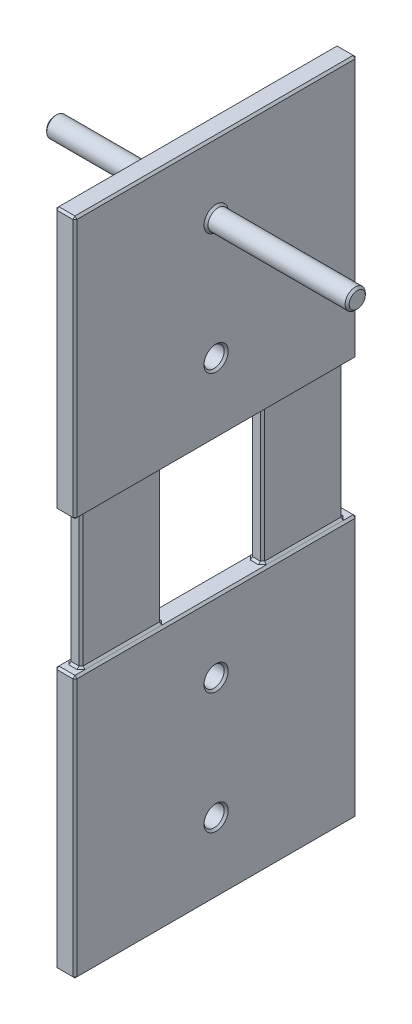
SolidWorks part; units mm, degrees
ref_plane "Спереди" through (0, 0, 0) normal (0, 0, 1) x (1, 0, 0)
ref_plane "Сверху" through (0, 0, 0) normal (0, 1, 0) x (1, 0, 0)
ref_plane "Справа" through (0, 0, 0) normal (1, 0, 0) x (0, 0, -1)
sketch "Эскиз1" plane through (0, 0, 0) normal (1, 0, 0) x (0, 0, -1)
  line L0 (0, 16.365) -> (0, -16.365) construction
  line L1 (-7, 0) -> (7, 0) construction
  line L2 (7, -3.365) -> (7, -16.365)
  line L3 (7, 3.365) -> (-7, 3.365)
  line L4 (7, 3.365) -> (7, 16.365)
  line L5 (7, 16.365) -> (-7, 16.365)
  line L6 (-7, 3.365) -> (-7, 16.365)
  line L7 (7, 3.365) -> (-7, 16.365) construction
  line L8 (7, 16.365) -> (-7, 3.365) construction
  line L9 (7, -3.365) -> (-7, -3.365)
  line L10 (-7, -3.365) -> (-7, -16.365)
  line L11 (7, -16.365) -> (-7, -16.365)
  circle A0 centre (0, 12.865) radius 0.5
  circle A1 centre (0, 6.865) radius 0.5
  circle A2 centre (0, -12.865) radius 0.5
  circle A3 centre (0, -6.865) radius 0.5
  point P5 (0, 9.865)
  dimension "D4" = 1
  dimension "D1" = 14
  dimension "D2" = 13
  dimension "D3" = 6.73
  dimension "D5" = 3.5
  dimension "D6" = 3.5
extrude "Бобышка-Вытянуть1" add sketch "Эскиз1" along normal mid plane 1
sketch "Эскиз3" plane through (0, 0, 0) normal (1, 0, 0) x (0, 0, -1)
  circle A0 centre (0, 12.865) radius 0.5 construction
  circle A1 centre (0, 12.865) radius 0.5
extrude "Бобышка-Вытянуть3" add sketch "Эскиз3" along normal mid plane 15
sketch "Эскиз2" plane through (0, 0, 0) normal (1, 0, 0) x (0, 0, -1)
  line L0 (0, 3.365) -> (0, -3.365) construction
  line L1 (-7, 3.365) -> (7, 3.365) construction
  line L2 (7, -3.365) -> (-7, -3.365) construction
  line L3 (-7, 16.365) -> (-7, 3.365) construction
  line L4 (-2.5, -3.365) -> (-6.5, -3.365)
  line L5 (-2.5, -3.365) -> (-2.5, 3.365)
  line L6 (-2.5, 3.365) -> (-6.5, 3.365)
  line L7 (-6.5, -3.365) -> (-6.5, 3.365)
  line L8 (-2.5, -3.365) -> (-6.5, 3.365) construction
  line L9 (-2.5, 3.365) -> (-6.5, -3.365) construction
  line L10 (2.5, -3.365) -> (2.5, 3.365)
  line L11 (2.5, -3.365) -> (6.5, -3.365)
  line L12 (6.5, -3.365) -> (6.5, 3.365)
  line L13 (2.5, 3.365) -> (6.5, 3.365)
  point P6 (-4.5, 0)
  dimension "D1" = 4
  dimension "D2" = 0.5
extrude "Бобышка-Вытянуть2" add sketch "Эскиз2" along normal mid plane 0.6
chamfer "Фаска1" distance 0.1 angle 45 34 edges at (-0.5, 6.865, -0.5) (-0.5, 12.865, -0.5) (-0.5, -6.865, 0.5) (-0.5, -12.865, 0.5) (0.5, -6.865, 0.5) (0, -16.365, -7) (0, -3.365, -7) (0, -3.365, 7) (-0.5, -9.865, 7) (-0.5, -3.365, 0) (-0.5, -9.865, -7) (-0.5, -16.365, 0) (0, -16.365, 7) (0.5, -9.865, -7) (0.5, -16.365, 0) (0.5, -9.865, 7) (0.5, -3.365, 0) (0.5, -12.865, 0.5) (0.5, 6.865, -0.5) (0, 16.365, 7) (0, 3.365, 7) (0, 3.365, -7) (-0.5, 3.365, 0) (-0.5, 9.865, -7) (-0.5, 9.865, 7) (-0.5, 16.365, 0) (0, 16.365, -7) (0.5, 16.365, 0) (0.5, 9.865, -7) (0.5, 3.365, 0) (0.5, 9.865, 7) (0.5, 12.865, -0.5) (7.5, 12.865, -0.5) (-7.5, 12.865, -0.5)
chamfer "Фаска2" distance 0.1 angle 45 24 edges at (0, 3.365, -2.5) (0, -3.365, -2.5) (0, -3.365, -6.5) (0, 3.365, -6.5) (0, 3.365, 2.5) (0, -3.365, 2.5) (0, -3.365, 6.5) (0, 3.365, 6.5) (0.3, 0, -2.5) (-0.3, 0, -2.5) (-0.3, -3.365, -4.5) (-0.3, 3.365, -4.5) (0.3, -3.365, -4.5) (0.3, 3.365, -4.5) (-0.3, 0, -6.5) (0.3, 0, -6.5) (-0.3, 0, 2.5) (0.3, 0, 2.5) (-0.3, 3.365, 4.5) (-0.3, -3.365, 4.5) (0.3, -3.365, 4.5) (0.3, 3.365, 4.5) (-0.3, 0, 6.5) (0.3, 0, 6.5)
